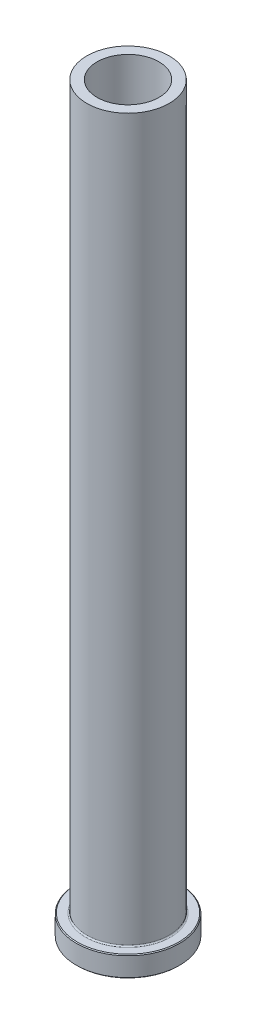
SolidWorks part; units mm, degrees
ref_plane "Front Plane" through (0, 0, 0) normal (0, 0, 1) x (1, 0, 0)
ref_plane "Top Plane" through (0, 0, 0) normal (0, 1, 0) x (1, 0, 0)
ref_plane "Right Plane" through (0, 0, 0) normal (1, 0, 0) x (0, 0, -1)
sketch "Sketch1" plane through (0, 0, 0) normal (0, 0, 1) x (1, 0, 0)
  line L0 (0, 0) -> (0, 50000) construction
  line L1 (0, 0) -> (15.875, 0)
  line L2 (15.875, 0) -> (15.875, 6.35)
  line L3 (15.875, 6.35) -> (13.0905, 6.35)
  line L4 (12.6936, 6.7469) -> (12.6936, 228.6)
  line L5 (12.6936, 228.6) -> (0, 228.6)
  line L6 (0, 228.6) -> (0, 0)
  arc A0 (12.6936, 6.7469) -> (13.0905, 6.35) centre (13.0905, 6.7469) ccw
  dimension "D5" = 0.3969
  dimension "D1" = 25.3873
  dimension "D2" = 31.75
  dimension "D3" = 6.35
  dimension "D4" = 228.6
revolve "Revolve1" add sketch "Sketch1" angle 360 about L0
sketch "Sketch2" plane through (0, 0, 0) normal (0, 0, 1) x (1, 0, 0)
  line L0 (0, 0) -> (0, 50000) construction
  line L1 (-15.875, 0) -> (15.875, 0) construction
  line L2 (10.1124, 0) -> (9.7155, 0.3969)
  line L3 (9.7155, 0.3969) -> (9.7155, 154.1145)
  line L4 (9.7155, 154.1145) -> (9.525, 168.402)
  line L5 (9.525, 168.402) -> (9.525, 228.6)
  line L6 (12.6936, 228.6) -> (-12.6936, 228.6) construction
  line L7 (9.525, 228.6) -> (0, 228.6)
  line L8 (0, 228.6) -> (0, 0)
  line L9 (0, 0) -> (10.1124, 0)
  point P4 (0, 0)
  dimension "D1" = 0.3969
  dimension "D2" = 45
  dimension "D3" = 19.05
  dimension "D4" = 19.431
  dimension "D5" = 60.198
  dimension "D6" = 14.2875
revolve "Cut-Revolve1" cut sketch "Sketch2" angle 360 about L0
chamfer "Chamfer1" distance 0.254 angle 45 2 edges at (0, 0, -15.875) (0, 6.35, -15.875)
